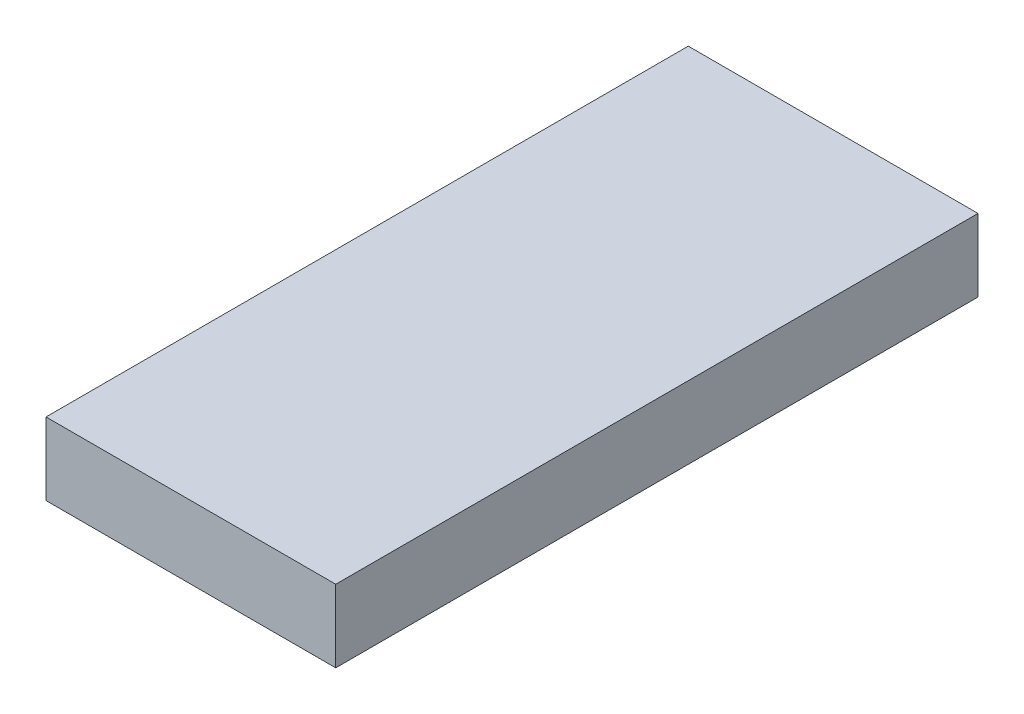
SolidWorks part; units mm, degrees
ref_plane "Plan de face" through (0, 0, 0) normal (0, 0, 1) x (1, 0, 0)
ref_plane "Plan de dessus" through (0, 0, 0) normal (0, 1, 0) x (1, 0, 0)
ref_plane "Plan de droite" through (0, 0, 0) normal (1, 0, 0) x (0, 0, -1)
sketch "Esquisse1" plane through (0, 0, 0) normal (0, 0, 1) x (1, 0, 0)
  line L1 (0, 0) -> (60, 0)
  line L2 (0, 0) -> (0, 15)
  line L3 (0, 15) -> (60, 15)
  line L4 (60, 0) -> (60, 15)
  dimension "D1" = 60
  dimension "D2" = 15
extrude "Extrusion1" add sketch "Esquisse1" along normal blind 133
